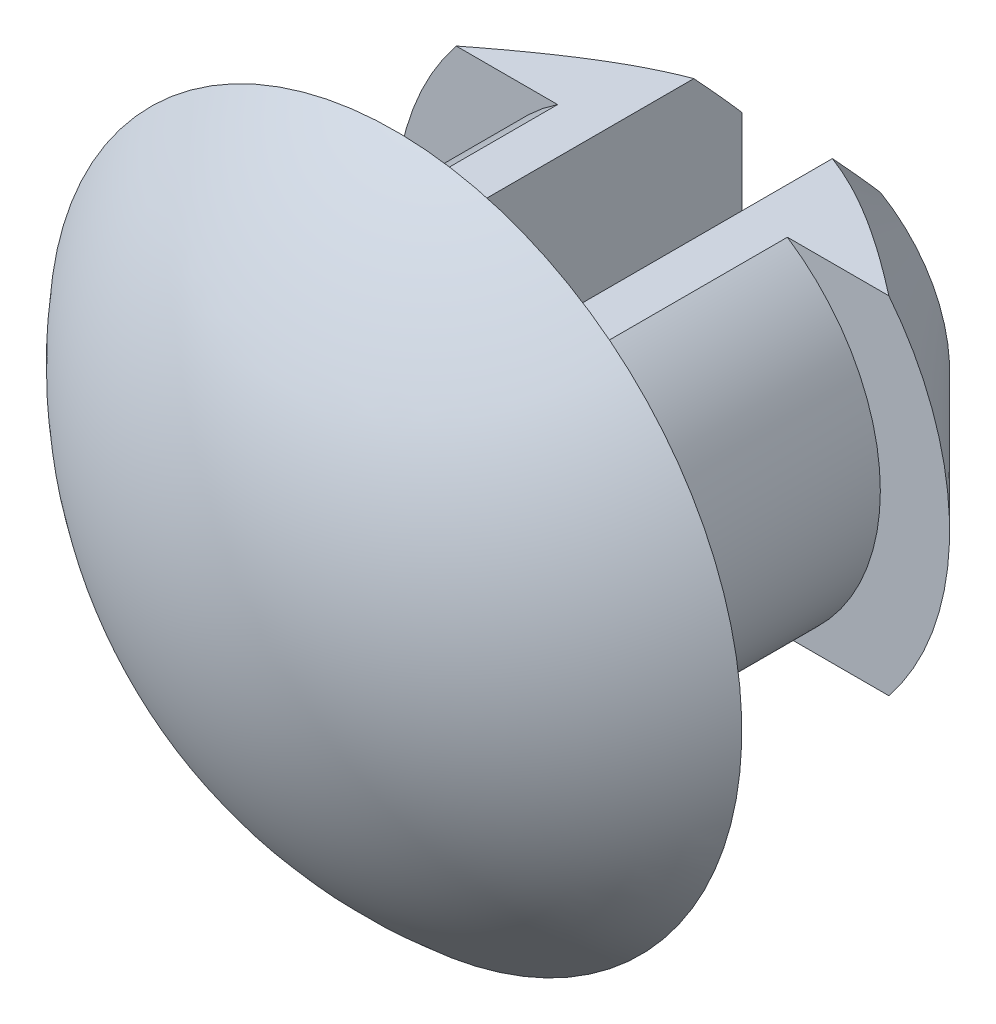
SolidWorks part; units mm, degrees
ref_plane "Plan de face" through (0, 0, 0) normal (0, 0, 1) x (1, 0, 0)
ref_plane "Plan de dessus" through (0, 0, 0) normal (0, 1, 0) x (1, 0, 0)
ref_plane "Plan de droite" through (0, 0, 0) normal (1, 0, 0) x (0, 0, -1)
sketch "Esquisse1" plane through (0, 0, 0) normal (0, 0, 1) x (1, 0, 0)
  circle A0 centre (0, 0) radius 1.5
  circle A1 centre (0, 0) radius 2.5
  dimension "D1" = 3
  dimension "D2" = 5
sketch "Esquisse2" plane through (0, 0, 0) normal (0, 1, 0) x (1, 0, 0)
  line L3 (-2.5, 0) -> (-1.5, 0)
  line L4 (-1.5, 0) -> (-1.5, 2)
  line L5 (-1.5, 2) -> (-2, 2)
  line L6 (-2, 2) -> (-1, 3)
  line L7 (-1, 3) -> (-0.5, 3)
  line L8 (-0.5, 3) -> (-0.5, 0)
  line L9 (-0.5, 0) -> (0, 0)
  line L12 (0, 0) -> (0, -1.1733)
  arc A0 (-2.5, 0) -> (0, -1.1733) centre (0, 2.0767) ccw
  arc A1 (0, -1.1733) -> (2.5, 0) centre (0, 2.0767) ccw construction
  dimension "D3" = 3.25
  dimension "D1" = 2
  dimension "D2" = 1
  dimension "D4" = 0.5
  dimension "D5" = 0.5
  dimension "D6" = 0.5
sketch "Esquisse3" plane through (0, 0, 0) normal (0, 1, 0) x (1, 0, 0)
  line L0 (-2.5, 0) -> (-1.5, 0) construction
  line L1 (-1.5, 0) -> (-1.5, 2) construction
  line L2 (-1.5, 2) -> (-2, 2) construction
  line L3 (-2, 2) -> (-1, 3) construction
  line L4 (-1, 3) -> (-0.5, 3) construction
  line L5 (-0.5, 3) -> (-0.5, 0) construction
  line L6 (-0.5, 0) -> (0, 0) construction
  line L7 (0, 0) -> (0, -1.1733) construction
  line L8 (-2.5, 0) -> (-1.5, 0)
  line L9 (-1.5, 0) -> (-1.5, 2)
  line L10 (-1.5, 2) -> (-2, 2)
  line L11 (-2, 2) -> (-1, 3)
  line L12 (-1, 3) -> (-0.5, 3)
  line L13 (-0.5, 3) -> (-0.5, 0)
  line L14 (-0.5, 0) -> (0, 0)
  line L15 (0, 0) -> (0, -1.1733)
  arc A0 (-2.5, 0) -> (0, -1.1733) centre (0, 2.0767) ccw construction
  arc A1 (-2.5, 0) -> (0, -1.1733) centre (0, 2.0767) ccw
revolve "Révolution2" add sketch "Esquisse3" angle 360 about L15
sketch "Esquisse4" plane through (0, 0, 0) normal (0, 1, 0) x (1, 0, 0)
  line L0 (-0.5, 3) -> (-0.5, 0) construction
  line L1 (-0.5, 0) -> (0, 0) construction
  line L2 (-0.5, 3) -> (-0.5, 0)
  line L3 (-0.5, 0) -> (0.5, 0)
  line L4 (0, 0) -> (0, -1.1733) construction
  line L5 (0, 0) -> (0, -1.1733) construction
  line L6 (0.5, 3) -> (0.5, 0)
  line L7 (-0.5, 3) -> (0.5, 3)
extrude "Enlèv. mat.-Extru.1" cut sketch "Esquisse4" against normal through all both and the other way through all
sketch "Esquisse5" plane through (0, 0, 0) normal (0, 0, -1) x (-1, 0, 0)
  line L1 (3.9547, 1.25) -> (-3.9547, 1.25)
  line L2 (3.9547, 1.25) -> (3.9547, -1.25)
  line L3 (3.9547, -1.25) -> (-3.9547, -1.25)
  line L4 (-3.9547, 1.25) -> (-3.9547, -1.25)
  line L5 (3.9547, 1.25) -> (-3.9547, -1.25) construction
  line L6 (3.9547, -1.25) -> (-3.9547, 1.25) construction
  point P0 (0, 0)
  dimension "D1" = 2.5
extrude "Enlèv. mat.-Extru.2" cut sketch "Esquisse5" along normal blind 10 flip side to cut
